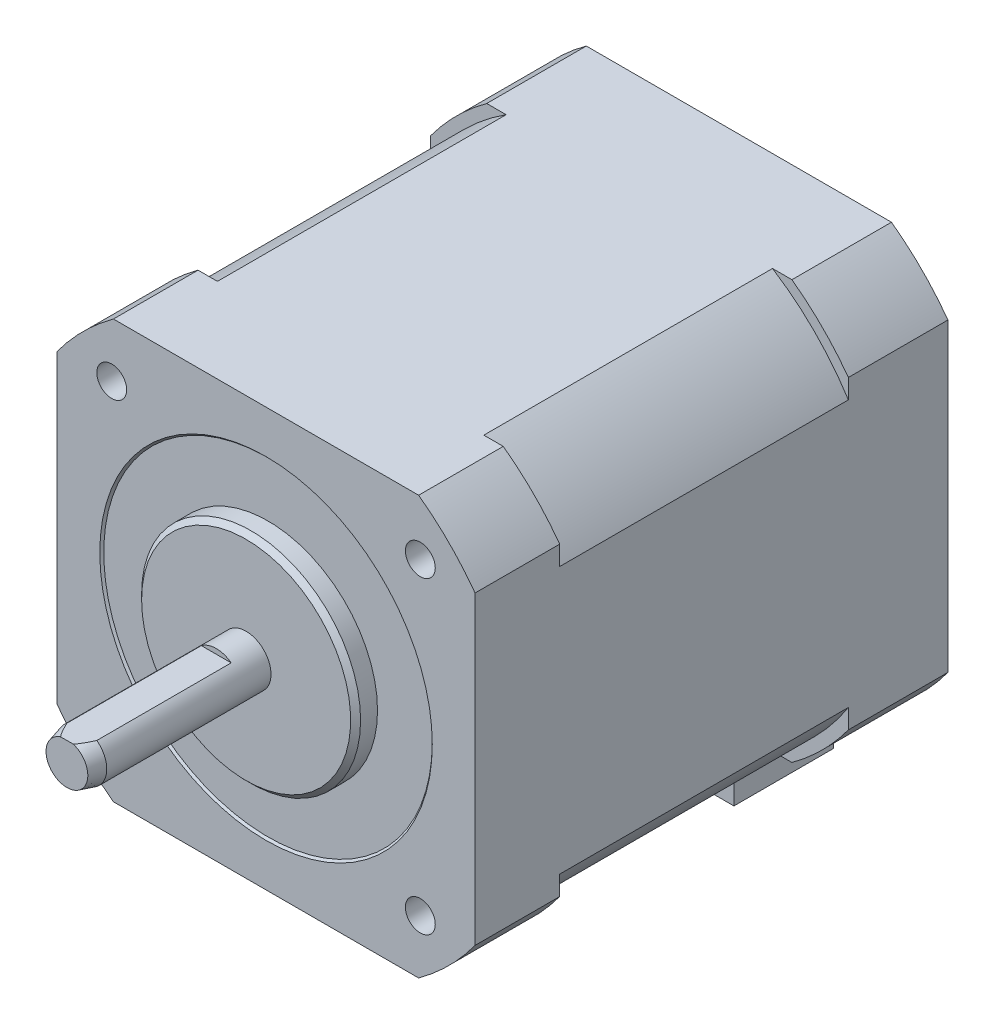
SolidWorks part; units mm, degrees
ref_plane "正面" through (0, 0, 0) normal (0, 0, 1) x (1, 0, 0)
ref_plane "平面" through (0, 0, 0) normal (0, 1, 0) x (1, 0, 0)
ref_plane "右側面" through (0, 0, 0) normal (1, 0, 0) x (0, 0, -1)
sketch "ｽｹｯﾁ1" plane through (0, 0, 0) normal (0, 0, 1) x (1, 0, 0)
  circle A0 centre (0, 0) radius 2.5
  dimension "D1" = 5
extrude "押し出し1" add sketch "ｽｹｯﾁ1" along normal blind 18
sketch "ｽｹｯﾁ2" plane through (0, 0, 0) normal (0, 0, -1) x (-1, 0, 0)
  circle A0 centre (0, 0) radius 11
  dimension "D1" = 22
extrude "押し出し2" add sketch "ｽｹｯﾁ2" along normal blind 2
sketch "ｽｹｯﾁ3" plane through (0, 0, -2) normal (0, 0, -1) x (-1, 0, 0)
  line L1 (-21, 21) -> (21, 21)
  line L2 (-21, 21) -> (-21, -21)
  line L3 (-21, -21) -> (21, -21)
  line L4 (21, 21) -> (21, -21)
  line L5 (-21, 21) -> (21, -21) construction
  line L6 (-21, -21) -> (21, 21) construction
  point P0 (0, 0)
  point P6 (0, 0)
  dimension "D1" = 42
  dimension "D2" = 42
extrude "押し出し3" add sketch "ｽｹｯﾁ3" along normal blind 8.5
sketch "Sketch8" plane through (0, 0, -2) normal (0, 0, 1) x (1, 0, 0)
  circle A0 centre (0, 0) radius 26
  dimension "D1" = 52
extrude "Extrude8" cut sketch "Sketch8" against normal blind 34 flip side to cut
sketch "Sketch9" plane through (0, 0, -10.5) normal (0, 0, -1) x (-1, 0, 0)
  line L4 (-21, 15.3297) -> (-21, -15.3297) construction
  line L5 (-15.3297, -21) -> (15.3297, -21) construction
  line L6 (21, -15.3297) -> (21, 15.3297) construction
  line L7 (15.3297, 21) -> (-15.3297, 21) construction
  line L8 (-21, 13.3795) -> (-21, -13.3795)
  line L9 (-13.3795, -21) -> (13.3795, -21)
  line L10 (21, -13.3795) -> (21, 13.3795)
  line L11 (13.3795, 21) -> (-13.3795, 21)
  arc A1 (21, 13.3795) -> (13.3795, 21) centre (0, 0) ccw
  arc A2 (-13.3795, 21) -> (-21, 13.3795) centre (0, 0) ccw
  arc A3 (-21, -13.3795) -> (-13.3795, -21) centre (0, 0) ccw
  arc A4 (13.3795, -21) -> (21, -13.3795) centre (0, 0) ccw
  dimension "D1" = 49.8
extrude "Extrude9" add sketch "Sketch9" along normal blind 29
sketch "Sketch14" plane through (0, 0, -2) normal (0, 0, 1) x (1, 0, 0)
  line L5 (15.5, -15.5) -> (-15.5, 15.5) construction
  line L6 (15.5, 15.5) -> (-15.5, -15.5) construction
  circle A0 centre (-15.5, 15.5) radius 1.5
  circle A1 centre (15.5, 15.5) radius 1.5
  circle A2 centre (15.5, -15.5) radius 1.5
  circle A3 centre (-15.5, -15.5) radius 1.5
  point P0 (0, 0)
  dimension "D3" = 3
  dimension "D4" = 3
  dimension "D5" = 3
  dimension "D6" = 3
  dimension "D1" = 31
  dimension "D2" = 31
  dimension "D7" = 15.5
  dimension "D8" = 15.5
  dimension "D9" = 31
  dimension "D10" = 31
extrude "Extrude13" cut sketch "Sketch14" against normal blind 4.5
sketch "Sketch11" plane through (0, 0, -39.5) normal (0, 0, -1) x (-1, 0, 0)
  line L0 (-21, 13.3795) -> (-21, -13.3795) construction
  line L1 (-21, 15.3297) -> (-21, 13.3795) construction
  line L2 (-21, -13.3795) -> (-21, -15.3297) construction
  line L3 (-13.3795, -21) -> (13.3795, -21) construction
  line L4 (-15.3297, -21) -> (-13.3795, -21) construction
  line L5 (13.3795, -21) -> (15.3297, -21) construction
  line L6 (21, -15.3297) -> (21, -13.3795) construction
  line L7 (21, -13.3795) -> (21, 13.3795) construction
  line L8 (21, 13.3795) -> (21, 15.3297) construction
  line L9 (15.3297, 21) -> (13.3795, 21) construction
  line L10 (-13.3795, 21) -> (-15.3297, 21) construction
  line L11 (-21, 13.3795) -> (-21, -13.3795)
  line L12 (-21, 15.3297) -> (-21, 13.3795)
  line L13 (-21, -13.3795) -> (-21, -15.3297)
  line L14 (-13.3795, -21) -> (13.3795, -21)
  line L15 (-15.3297, -21) -> (-13.3795, -21)
  line L16 (13.3795, -21) -> (15.3297, -21)
  line L17 (21, -15.3297) -> (21, -13.3795)
  line L18 (21, -13.3795) -> (21, 13.3795)
  line L19 (21, 13.3795) -> (21, 15.3297)
  line L20 (15.3297, 21) -> (13.3795, 21)
  line L21 (-13.3795, 21) -> (-15.3297, 21)
  line L22 (13.3795, 21) -> (-13.3795, 21) construction
  line L23 (13.3795, 21) -> (-13.3795, 21)
  arc A0 (-15.3297, 21) -> (-21, 15.3297) centre (0, 0) ccw construction
  arc A1 (-21, -15.3297) -> (-15.3297, -21) centre (0, 0) ccw construction
  arc A2 (15.3297, -21) -> (21, -15.3297) centre (0, 0) ccw construction
  arc A3 (21, 15.3297) -> (15.3297, 21) centre (0, 0) ccw construction
  arc A4 (-15.3297, 21) -> (-21, 15.3297) centre (0, 0) ccw
  arc A5 (-21, -15.3297) -> (-15.3297, -21) centre (0, 0) ccw
  arc A6 (15.3297, -21) -> (21, -15.3297) centre (0, 0) ccw
  arc A7 (21, 15.3297) -> (15.3297, 21) centre (0, 0) ccw
extrude "Extrude11" add sketch "Sketch11" along normal blind 10
chamfer "Chamfer5" distance 1.5 angle 15 1 edges at (2.5, 0, 18)
sketch "Sketch2" plane through (0, 0, 18) normal (0, 0, 1) x (1, 0, 0)
  line L1 (-4.7278, 5.1185) -> (3.4221, 5.1185)
  line L2 (-4.7278, 5.1185) -> (-4.7278, 2)
  line L3 (-4.7278, 2) -> (3.4221, 2)
  line L4 (3.4221, 5.1185) -> (3.4221, 2)
  dimension "D1" = 2
extrude "Extrude2" cut sketch "Sketch2" against normal blind 15
sketch "Sketch6" plane through (0, 0, -2) normal (0, 0, 1) x (1, 0, 0)
  circle A0 centre (0, 0) radius 16.5
  circle A1 centre (0, 0) radius 11 construction
  circle A2 centre (0, 0) radius 11
  dimension "D2" = 33
extrude "Extrude6" cut sketch "Sketch6" against normal blind 0.2
chamfer "Chamfer2" distance 0.5 angle 45 1 edges at (-11, 0, 0)
chamfer "Chamfer7" distance 0.2 angle 45 1 edges at (16.5, 0, -2)
sketch "Sketch13" plane through (0, -21, 0) normal (0, -1, 0) x (1, 0, 0)
  line L0 (15.3297, -49.5) -> (-15.3297, -49.5) construction
  line L1 (-9.5, -39.5) -> (9.5, -39.5)
  line L2 (-9.5, -39.5) -> (-9.5, -49.5)
  line L3 (-9.5, -49.5) -> (9.5, -49.5)
  line L4 (9.5, -39.5) -> (9.5, -49.5)
  line L5 (-21, -49.5) -> (-21, -39.5) construction
  dimension "D1" = 10
  dimension "11.5" = 11.5
  dimension "D2" = 19
extrude "Extrude12" add sketch "Sketch13" along normal blind 6.7
